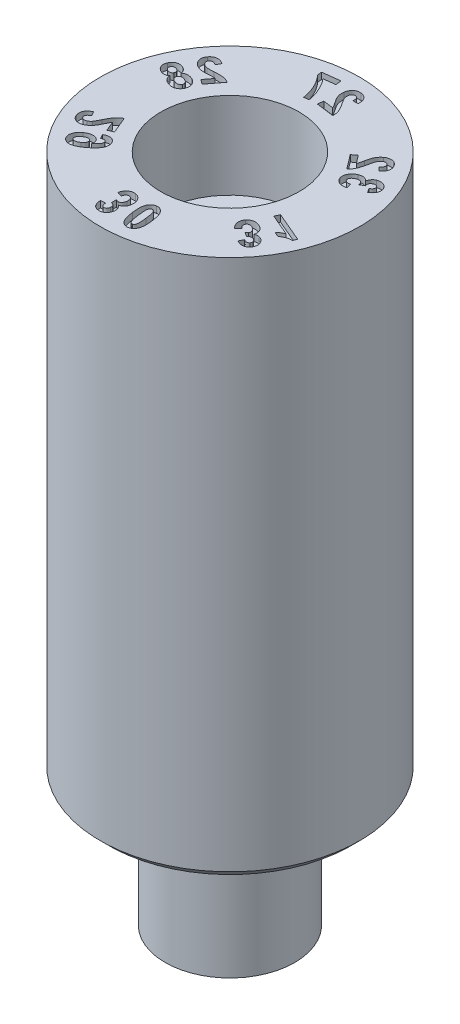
SolidWorks part; units mm, degrees
other "<M6L12-SetScrew>-<Chamfer1>" parameters "D10"=0.38
ref_plane "Front Plane" through (0, 0, 0) normal (0, 0, 1) x (1, 0, 0)
ref_plane "Top Plane" through (0, 0, 0) normal (0, 1, 0) x (1, 0, 0)
ref_plane "Right Plane" through (0, 0, 0) normal (1, 0, 0) x (0, 0, -1)
sketch "Sketch1" plane through (0, 0, 0) normal (0, 0, 1) x (1, 0, 0)
  line L0 (0, 0) -> (0, 20) construction
  line L1 (0, -6.6) -> (0, 6.6) construction
  line L2 (3, -25) -> (5.62, -25)
  line L4 (6, -24.62) -> (6, 0)
  line L5 (6, 0) -> (3.2, 0)
  line L6 (3.2, 0) -> (3.2, -4)
  line L7 (3.2, -4) -> (1.5, -4)
  line L8 (1.5, -4) -> (1.5, -17)
  line L9 (1.5, -17) -> (3, -17)
  line L10 (3, -17) -> (3, -25)
  line L11 (5.62, -25) -> (6, -24.62)
  point P6 (6, -25)
  dimension "D1" = 4
  dimension "D2" = 8
  dimension "D3" = 3
  dimension "D4" = 6.4
  dimension "D5" = 12
  dimension "D6" = 6
  dimension "D7" = 25
revolve "Revolve1" add sketch "Sketch1" angle 360 about L0
sketch "Sketch2" plane through (0, 0, 0) normal (0, 1, 0) x (1, 0, 0)
  line L0 (0, 0) -> (0, 4.1718) construction
  line L1 (0, 0) -> (3.6129, 2.0859) construction
  line L2 (0, 0) -> (3.6129, -2.0859) construction
  line L3 (0, 0) -> (0, -4.1718) construction
  line L4 (0, 0) -> (-3.6129, -2.0859) construction
  line L5 (0, 0) -> (-3.6129, 2.0859) construction
  arc A0 (0.9715, 3.8287) -> (1.8289, 3.5011) centre (0, 0) ccw construction
  text T0 "27    28    29    30    31    32" font "Arial Narrow" height 1.5
  point P12 (0, 0)
  point P16 (0, 0)
  point P17 (0, 0)
  point P20 (0, 0)
  point P24 (0, 0)
  dimension "D1" = 7.9
  dimension "D2" = 6
extrude "Cut-Extrude1" cut sketch "Sketch2" against normal blind 0.3
inserted part "M6L12-SetScrew"
move or copy body "Body-Move/Copy2" placed by mates yes
other "Distance1" parameters "D1"=6
